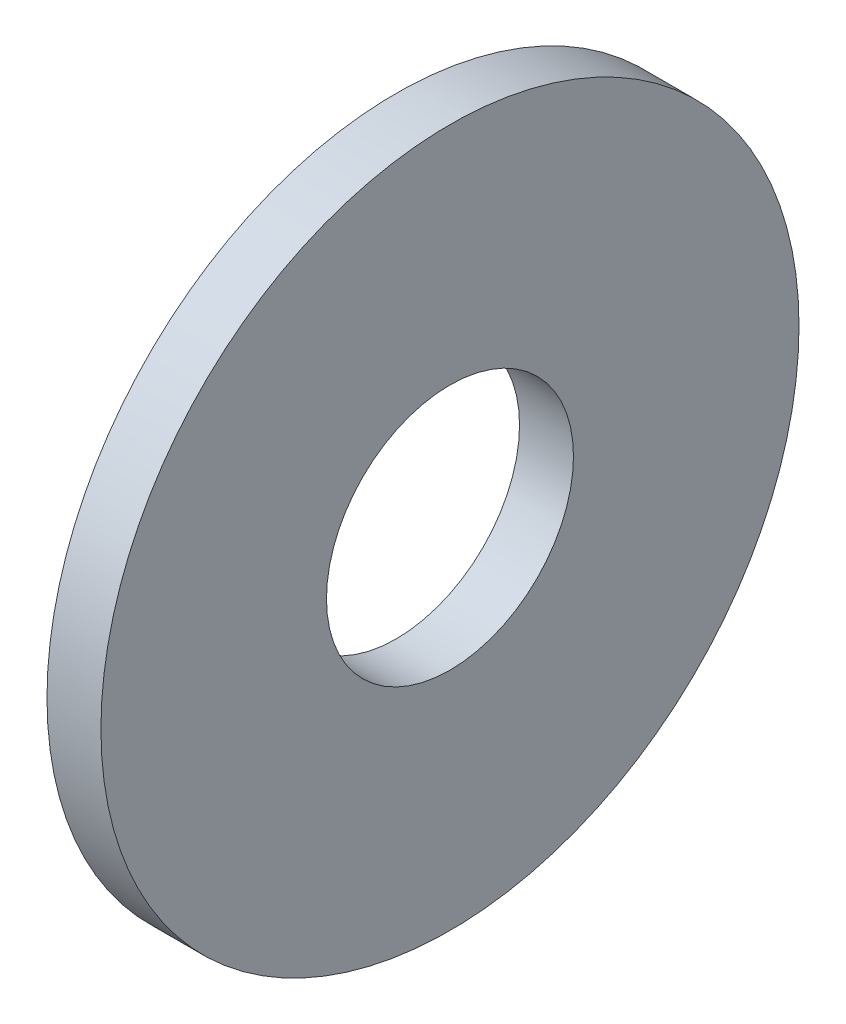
SolidWorks part; units mm, degrees
ref_plane "Plane1" through (0, 0, 0) normal (0, 0, 1) x (1, 0, 0)
ref_plane "Plane2" through (0, 0, 0) normal (0, 1, 0) x (1, 0, 0)
ref_plane "Plane3" through (0, 0, 0) normal (1, 0, 0) x (0, 0, -1)
other "Configuration Table"
sketch "Sketch1" plane through (0, 0, 0) normal (0, 0, 1) x (1, 0, 0)
  line L0 (-34.925, 0) -> (9.525, 0) construction
  line L1 (0, 19.46) -> (0, 55)
  line L2 (0, 55) -> (-8.5, 55)
  line L3 (-8.5, 55) -> (-8.5, 19.46)
  line L4 (-8.5, 19.46) -> (0, 19.46)
  dimension "Thickness" = 8.5
  dimension "Inside_dia" = 38.92
  dimension "Outside_dia" = 110
revolve "Base-Revolve" add sketch "Sketch1" angle 360 about L0
